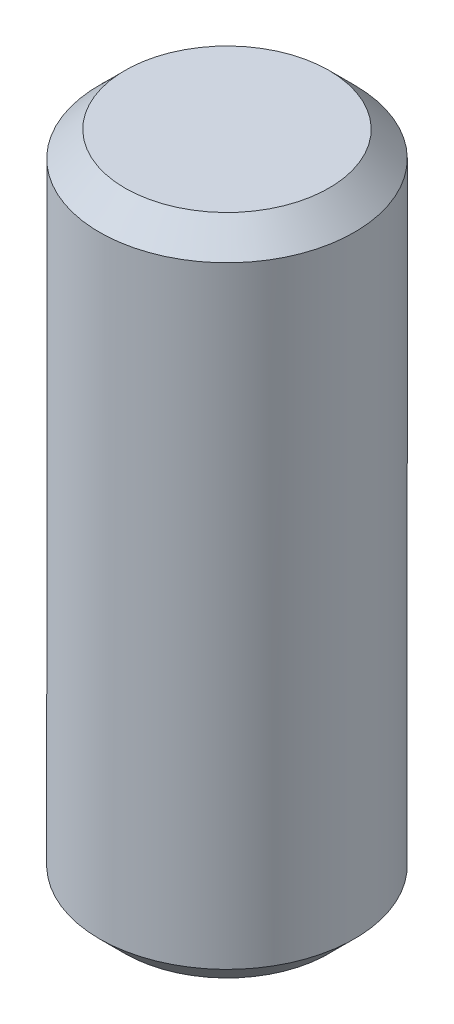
SolidWorks part; units mm, degrees
ref_plane "Front Plane" through (0, 0, 0) normal (0, 0, 1) x (1, 0, 0)
ref_plane "Top Plane" through (0, 0, 0) normal (0, 1, 0) x (1, 0, 0)
ref_plane "Right Plane" through (0, 0, 0) normal (1, 0, 0) x (0, 0, -1)
sketch "Sketch1" plane through (0, 0, 0) normal (0, 1, 0) x (1, 0, 0)
  circle A0 centre (0, 0) radius 10
  dimension "D1" = 20
extrude "Boss-Extrude1" add sketch "Sketch1" along normal blind 52
chamfer "Chamfer1" distance 2 angle 45 2 edges at (0, 0, 10) (0, 52, 10)
